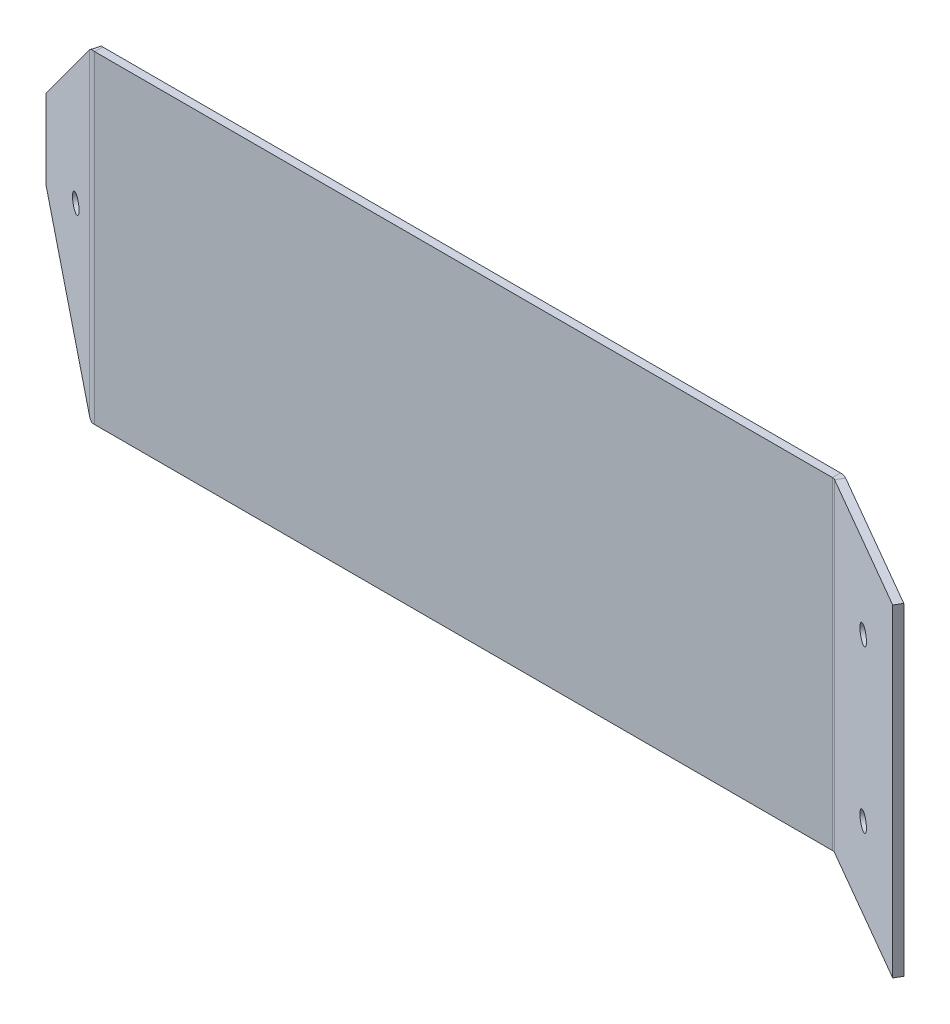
SolidWorks part; units mm, degrees
ref_plane "Face" through (0, 0, 0) normal (0, 0, 1) x (1, 0, 0)
ref_plane "Dessus" through (0, 0, 0) normal (0, 1, 0) x (1, 0, 0)
ref_plane "Droite" through (0, 0, 0) normal (1, 0, 0) x (0, 0, -1)
sketch "Esquisse1" plane through (0, 0, 0) normal (0, 0, 1) x (1, 0, 0)
  line L0 (-172.572, 0) -> (10.509, 0) construction
  line L1 (0, 34.4696) -> (0, -31.6672) construction
  line L2 (-172.572, 20) -> (24.5211, 20) construction
  line L3 (-165, 31.387) -> (-165, -35.3103) construction
  line L4 (-165, -5) -> (-165, 5)
  line L5 (-150, 20) -> (-38, 20)
  line L6 (-38, 20) -> (-38, -20)
  line L7 (-165, 5) -> (-150, 20)
  line L8 (-165, -5) -> (-150, -20)
  line L9 (-150, -20) -> (-38, -20)
  point P8 (-165, -20)
  point P9 (-165, 20)
  point P11 (-165, 0)
  point P17 (-38, 0)
  dimension "D3" = 15
  dimension "D1" = 15
  dimension "D2" = 15
  dimension "D4" = 40
  dimension "D5" = 127
extrude "Base-Extrusion" add sketch "Esquisse1" along normal blind 1
sketch "Esquisse2" plane through (0, 0, 1) normal (0, 0, 1) x (1, 0, 0)
  line L0 (-143.7054, 0) -> (15.5032, 0) construction
  line L1 (-38, 20) -> (-150, 20) construction
  line L2 (-150, -20) -> (-38, -20) construction
  line L3 (-139.9641, -10) -> (0, -10) construction
  line L4 (-139.9641, 10) -> (-7.383, 10) construction
  line L5 (-38, -20) -> (-38, 20) construction
  line L7 (-48, 22.8017) -> (-48, -26.8472) construction
  line L9 (-165, 5) -> (-165, -5) construction
  circle A0 centre (-155, 0) radius 1.1
  circle A5 centre (-48, 10) radius 1.1
  circle A8 centre (-48, -10) radius 1.1
  dimension "D1" = 10
  dimension "D3" = 10
  dimension "D2" = 10
  dimension "D7" = 10
extrude "Enlèv. mat.-Extru.1" cut sketch "Esquisse2" against normal through all
sheet metal parameters "Tôlerie 1" parameters "D1"=0.7366
flatten bends "Dépliage 1" parameters "D1"=0
sketch "Esquisse-Angle1" plane through (0, 0, 1) normal (0, 0, 1) x (1, 0, 0)
process bends "Pliage 1" parameters "D1"=0
sketch "Esquisse-Plate1" plane through (0, 0, 1) normal (0, 0, 1) x (1, 0, 0)
sketch "Esquisse6" plane through (0, 0, 1) normal (0, 0, 1) x (1, 0, 0)
  line L0 (-58, 39.4121) -> (-58, -34.0641)
  line L2 (-38, -20) -> (-38, 20) construction
  dimension "D1" = 20
sketched bend "Pli esquissé2" parameters "D1"=0.7366
bend "Pli esquissé3" bend radius 0.7366 bend angle 30 parameters "D5"=1
sketch "Esquisse8" plane through (0, 0, 0) normal (0, 0, -1) x (-1, 0, 0)
  line L0 (150, -28.7162) -> (150, 31.9714)
  line L1 (165, 5) -> (165, -5) construction
  dimension "D1" = 15
sketched bend "Pli esquissé4" parameters "D1"=0.7366
bend "Pli esquissé5" bend radius 0.7366 bend angle 30 parameters "D5"=2
flat pattern "Etat déplié1"
sketch "Lignes de pliage1" plane through (0, 0, 1) normal (0, 0, 1) x (1, 0, 0)
  line L0 (-150, -20) -> (-150, 20) construction
  line L1 (-50, -20) -> (-50, 20) construction
bend of the flat pattern "Dépliage-<Pli esquissé3>1"
bend of the flat pattern "Dépliage-<Pli esquissé5>1"
